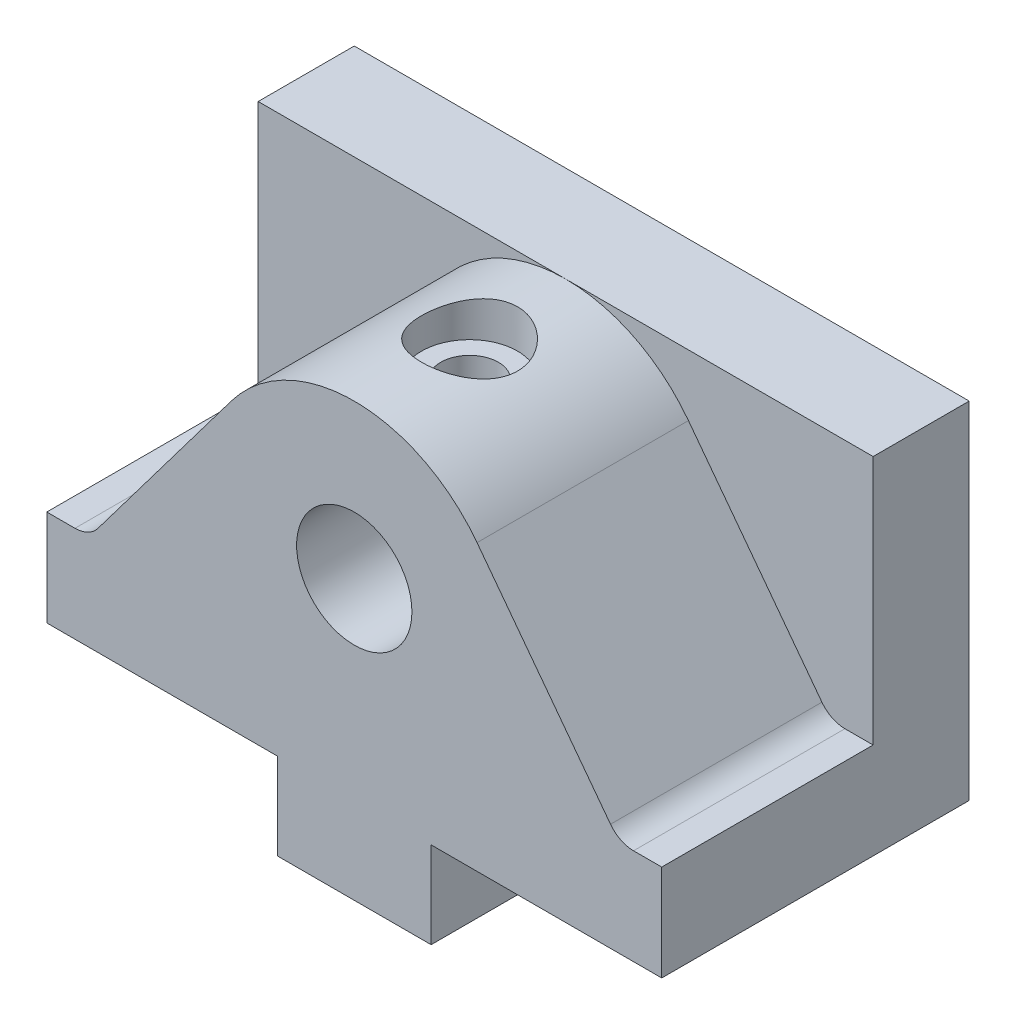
SolidWorks part; units mm, degrees
ref_plane "Front Plane" through (0, 0, 0) normal (0, 0, 1) x (1, 0, 0)
ref_plane "Top Plane" through (0, 0, 0) normal (0, 1, 0) x (1, 0, 0)
ref_plane "Right Plane" through (0, 0, 0) normal (1, 0, 0) x (0, 0, -1)
sketch "Sketch1" plane through (0, 0, 0) normal (0, 0, 1) x (1, 0, 0)
  line L0 (0, 0) -> (0, 40.9271) construction
  line L1 (-32, 0) -> (-8, 0)
  line L2 (-8, 0) -> (-8, -9)
  line L3 (-8, -9) -> (8, -9)
  line L4 (8, -9) -> (8, 0)
  line L5 (8, 0) -> (32, 0)
  line L6 (32, 0) -> (32, 10)
  line L7 (32, 10) -> (27.5697, 10)
  line L8 (27.5697, 10) -> (12.7782, 29.629)
  line L9 (-12.7782, 29.629) -> (-27.5697, 10)
  line L10 (-27.5697, 10) -> (-32, 10)
  line L11 (-32, 10) -> (-32, 0)
  arc A0 (12.7782, 29.629) -> (-12.7782, 29.629) centre (0, 20) ccw
  dimension "D7" = 16
  dimension "D1" = 16
  dimension "D2" = 64
  dimension "D3" = 10
  dimension "D4" = 9
  dimension "D5" = 36
  dimension "D6" = 74
extrude "Boss-Extrude1" add sketch "Sketch1" along normal blind 22
sketch "Sketch2" plane through (0, 0, 0) normal (0, 0, -1) x (-1, 0, 0)
  line L0 (-32, 0) -> (-32, 10) construction
  line L1 (-8, 0) -> (-32, 0) construction
  line L2 (-8, -9) -> (-8, 0) construction
  line L3 (8, -9) -> (-8, -9) construction
  line L4 (8, 0) -> (8, -9) construction
  line L5 (32, 0) -> (8, 0) construction
  line L6 (32, 10) -> (32, 0) construction
  line L7 (-32, 0) -> (-32, 10)
  line L8 (-8, 0) -> (-32, 0)
  line L9 (-8, -9) -> (-8, 0)
  line L10 (8, -9) -> (-8, -9)
  line L11 (8, 0) -> (8, -9)
  line L12 (32, 0) -> (8, 0)
  line L13 (32, 10) -> (32, 0)
  line L14 (-32, 36) -> (32, 36)
  line L15 (-32, 36) -> (-32, 10)
  line L17 (32, 36) -> (32, 10)
  arc A0 (12.7782, 29.629) -> (-12.7782, 29.629) centre (0, 20) ccw construction
extrude "Boss-Extrude2" add sketch "Sketch2" along normal blind 10
fillet "Fillet1" radius 3 2 edges at (-27.5697, 10, 11) (27.5697, 10, 11)
sketch "Sketch3" plane through (0, 0, 22) normal (0, 0, 1) x (1, 0, 0)
  circle A0 centre (0, 20) radius 6
  arc A1 (12.7782, 29.629) -> (-12.7782, 29.629) centre (0, 20) ccw construction
  dimension "D1" = 12
extrude "Cut-Extrude1" cut sketch "Sketch3" against normal blind 24
hole_wizard "Ø6.0 (6) Diameter Hole1" positions "Sketch5" profile "Sketch4" hole size "Ø6.0" standard "Ansi Metric"
sketch "Sketch5" plane through (0, -9, 0) normal (0, -1, 0) x (1, 0, 0)
  line L0 (-8, 22) -> (8, 22) construction
  point P0 (0, 14)
  point P1 (0, -2)
  dimension "D1" = 8
  dimension "D2" = 16
sketch "Sketch4" plane through (0, -9, 14) normal (1, 0, 0) x (0, 0, -1)
  line L0 (0, 0) -> (0, 17.8026)
  line L1 (0, 17.8026) -> (3, 16)
  line L2 (3, 16) -> (3, 0)
  line L5 (3, 0) -> (0, 0)
  line L10 (0, 17.8026) -> (-3, 16) construction
  line L11 (0, -6.35) -> (0, 107.95) construction
  dimension "Hole Dia." = 6
  dimension "Hole Depth" = 16
  dimension "Drill Angle" = 118
hole_wizard "CBORE for M6 SBHCS1" positions "Sketch12" profile "Sketch11" counterbore size "M6" standard "Ansi Metric"
sketch "Sketch12" plane through (0, 36, 0) normal (0, 1, 0) x (-1, 0, 0)
  line L0 (32, -10) -> (-32, -10) construction
  point P0 (0, 10)
  dimension "D1" = 20
sketch "Sketch11" plane through (0, 36, 10) normal (1, 0, 0) x (0, 0, 1)
  line L0 (0, 0) -> (0, 10)
  line L1 (0, 10) -> (3, 10)
  line L3 (3, 10) -> (3, 4)
  line L4 (3, 4) -> (5, 4)
  line L5 (5, 4) -> (5, 0)
  line L7 (5, 0) -> (0, 0)
  line L11 (0, -6.35) -> (0, 107.95) construction
  dimension "Thru Hole Dia." = 6
  dimension "Thru Hole Depth" = 10
  dimension "C'Bore Dia." = 10
  dimension "C'Bore Depth" = 4
